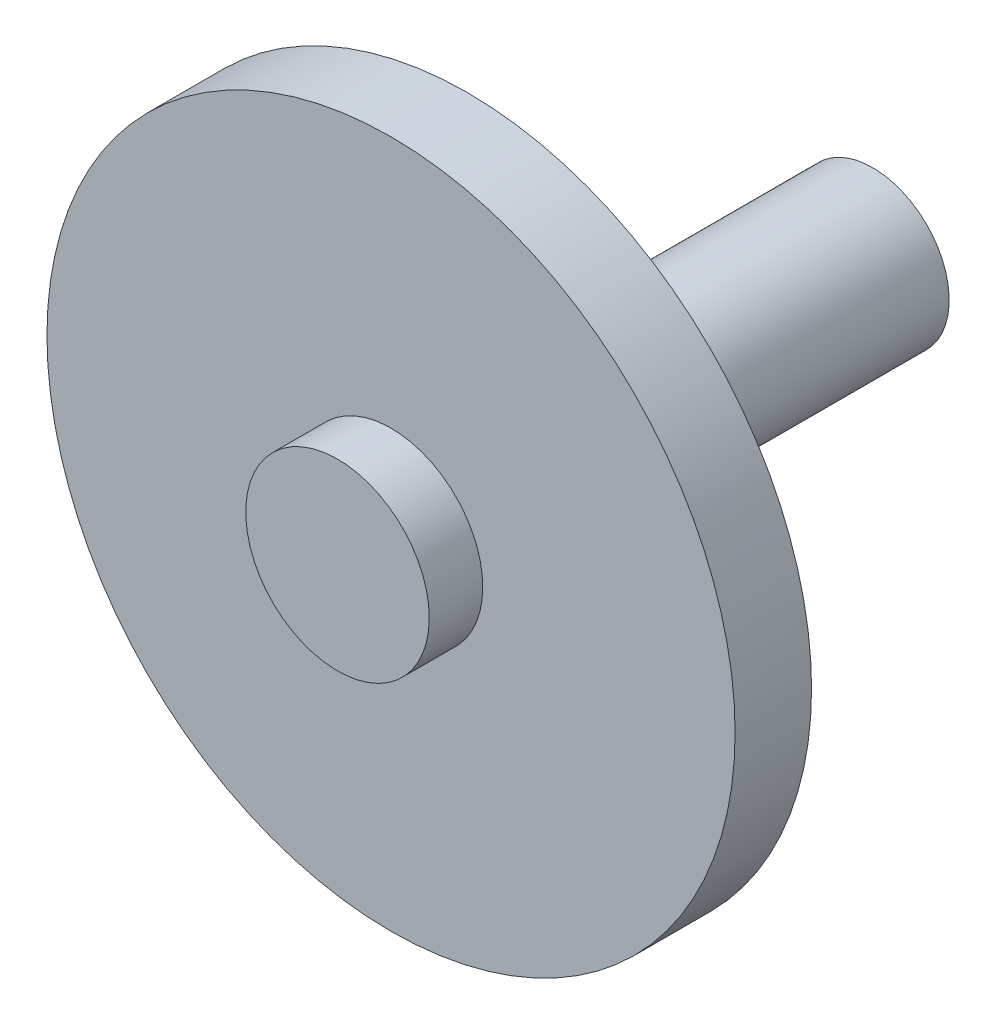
SolidWorks part; units mm, degrees
ref_plane "Front Plane" through (0, 0, 0) normal (0, 0, 1) x (1, 0, 0)
ref_plane "Top Plane" through (0, 0, 0) normal (0, 1, 0) x (1, 0, 0)
ref_plane "Right Plane" through (0, 0, 0) normal (1, 0, 0) x (0, 0, -1)
sketch "Sketch1" plane through (0, 0, 0) normal (0, 0, 1) x (1, 0, 0)
  circle A0 centre (0, 0) radius 22.5
  dimension "D1" = 45
extrude "Boss-Extrude1" add sketch "Sketch1" along normal blind 5
sketch "Sketch2" plane through (0, 0, 5) normal (0, 0, 1) x (1, 0, 0)
  circle A0 centre (0, 0) radius 6
  dimension "D1" = 12
extrude "Boss-Extrude2" add sketch "Sketch2" along normal blind 3.5
sketch "Sketch3" plane through (0, 0, 0) normal (0, 0, -1) x (-1, 0, 0)
  circle A0 centre (0, 0) radius 7.5
  dimension "D1" = 15
extrude "Boss-Extrude3" add sketch "Sketch3" along normal blind 2
sketch "Sketch4" plane through (0, 0, -2) normal (0, 0, -1) x (-1, 0, 0)
  circle A0 centre (0, 0) radius 5.5
  dimension "D1" = 11
extrude "Boss-Extrude4" add sketch "Sketch4" along normal blind 6
sketch "Sketch5" plane through (0, 0, -8) normal (0, 0, -1) x (-1, 0, 0)
  circle A0 centre (0, 0) radius 5
  dimension "D1" = 10
extrude "Boss-Extrude5" add sketch "Sketch5" along normal blind 18.5
